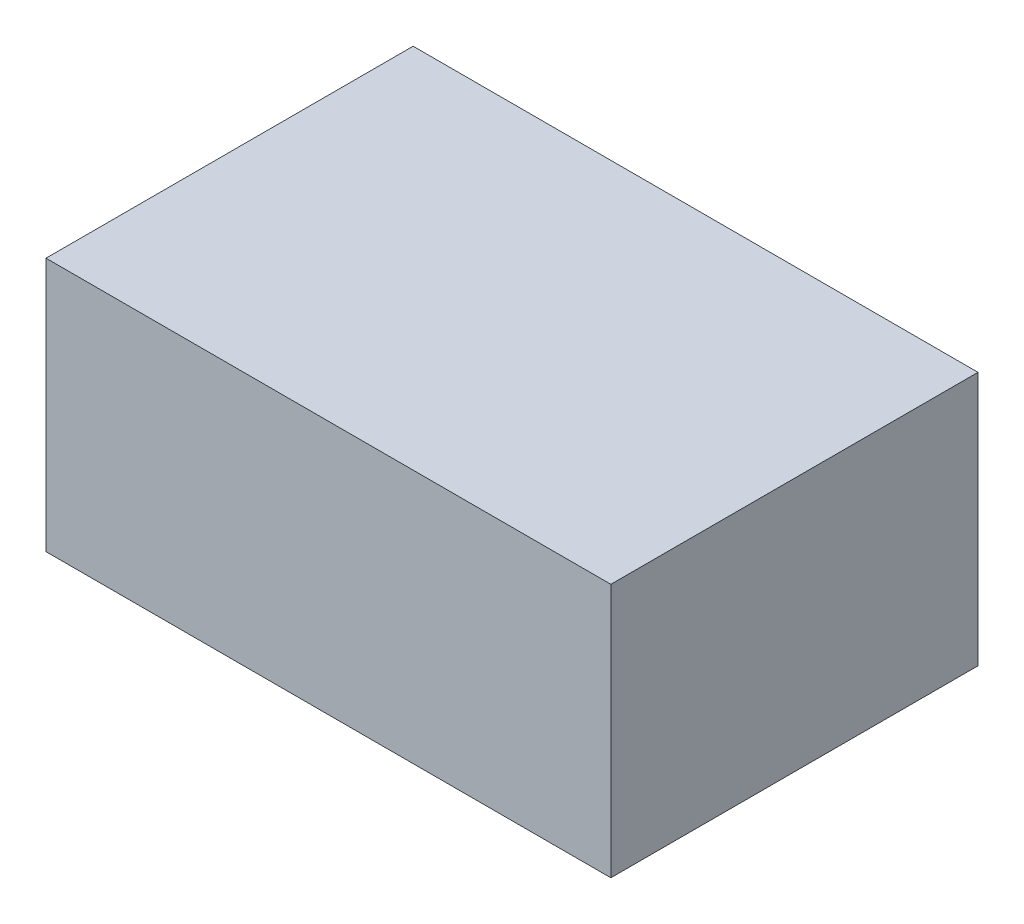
SolidWorks part; units mm, degrees
ref_plane "Front Plane" through (0, 0, 0) normal (0, 0, 1) x (1, 0, 0)
ref_plane "Top Plane" through (0, 0, 0) normal (0, 1, 0) x (1, 0, 0)
ref_plane "Right Plane" through (0, 0, 0) normal (1, 0, 0) x (0, 0, -1)
sketch "Sketch1" plane through (0, 0, 0) normal (0, 1, 0) x (1, 0, 0)
  line L1 (0, 0) -> (101.6, 0)
  line L2 (0, 0) -> (0, 66.04)
  line L3 (0, 66.04) -> (101.6, 66.04)
  line L4 (101.6, 0) -> (101.6, 66.04)
  dimension "D1" = 66.04
  dimension "D2" = 101.6
extrude "Boss-Extrude1" add sketch "Sketch1" along normal blind 45.72
